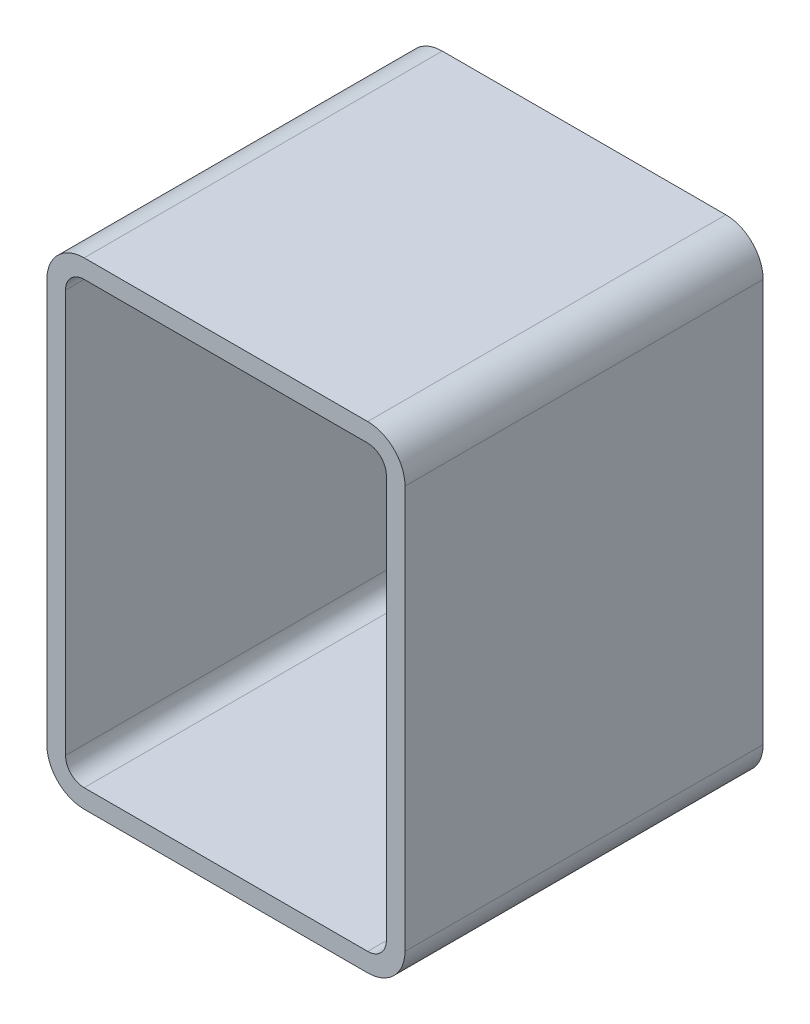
SolidWorks part; units mm, degrees
ref_plane "Front Plane" through (0, 0, 0) normal (0, 0, 1) x (1, 0, 0)
ref_plane "Top Plane" through (0, 0, 0) normal (0, 1, 0) x (1, 0, 0)
ref_plane "Right Plane" through (0, 0, 0) normal (1, 0, 0) x (0, 0, -1)
sketch "Sketch1" plane through (0, 0, 0) normal (0, 0, 1) x (1, 0, 0)
sketch_block_instance "HSS16x12x0.625-1"
sketch_block "HSS16x12x0.625"
extrude "Boss-Extrude1" add sketch "Sketch1" along normal blind 304.8
